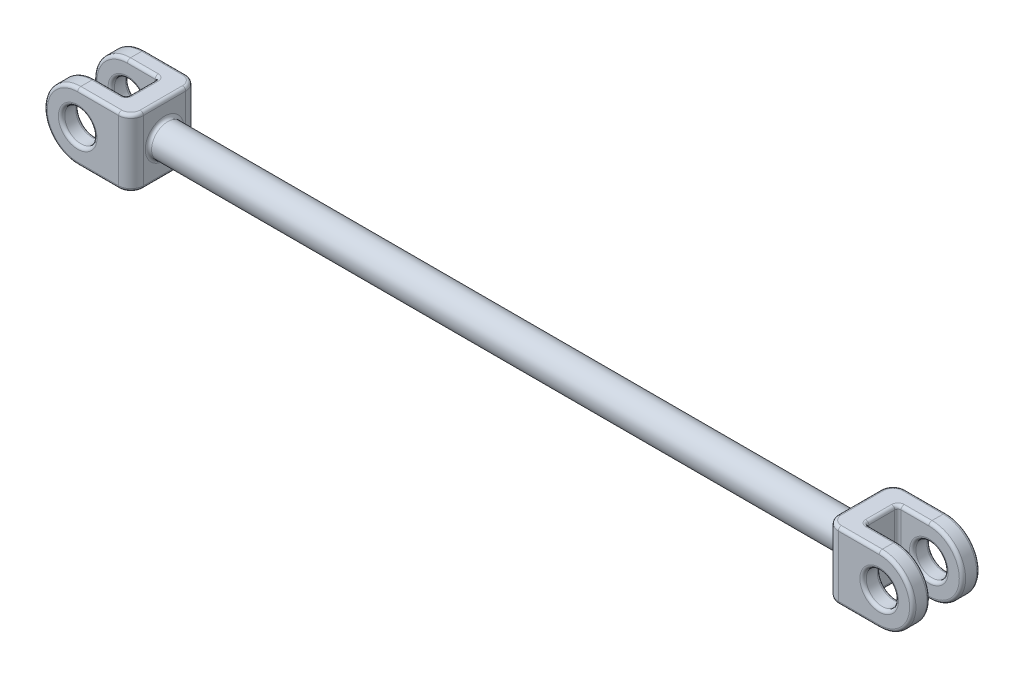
SolidWorks part; units mm, degrees
ref_plane "Front Plane" through (0, 0, 0) normal (0, 0, 1) x (1, 0, 0)
ref_plane "Top Plane" through (0, 0, 0) normal (0, 1, 0) x (1, 0, 0)
ref_plane "Right Plane" through (0, 0, 0) normal (1, 0, 0) x (0, 0, -1)
sketch "Sketch1" plane through (0, 0, 0) normal (0, 0, 1) x (1, 0, 0)
  line L1 (0, 8.5852) -> (0, -8.5852) construction
  line L9 (0, -8.5852) -> (13.6398, -8.5852)
  line L10 (13.6398, -8.5852) -> (13.6398, 8.5852)
  line L11 (13.6398, 8.5852) -> (0, 8.5852)
  arc A0 (0, 8.5852) -> (0, -8.5852) centre (0, 0) ccw
  circle A1 centre (0, 0) radius 4.1275
  dimension "D3" = 8.255
  dimension "D1" = 17.1704
  dimension "D2" = 22.225
extrude "Extrude1" add sketch "Sketch1" along normal mid plane 17.1704
sketch "Sketch4" plane through (0, 8.5852, 0) normal (0, 1, 0) x (-1, 0, 0)
  line L0 (0, 0) -> (14.7841, 0) construction
  line L1 (8.5852, -4.1275) -> (8.5852, 4.1275)
  line L3 (8.5852, -4.1275) -> (-7.9248, -4.1275)
  line L4 (8.5852, 4.1275) -> (-7.9248, 4.1275)
  line L5 (-7.9248, -4.1275) -> (-7.9248, 4.1275)
  line L6 (8.5852, -8.5852) -> (8.5852, 8.5852) construction
  point P8 (8.5852, 0)
  point P11 (-7.9248, 0)
  dimension "D1" = 8.255
  dimension "D2" = 16.51
extrude "Cut-Extrude2" cut sketch "Sketch4" against normal through all
sketch "Sketch8" plane through (13.6398, 0, 0) normal (1, 0, 0) x (0, 0, -1)
  circle A0 centre (0, 0) radius 4.1275
  dimension "D1" = 8.255
extrude "Extrude3" add sketch "Sketch8" along normal blind 88.9
mirror "Mirror1" about plane through (102.5398, 0, 0) normal (1, 0, 0)
fillet "Fillet5" radius 3.175 4 edges at (191.4398, 0, -8.5852) (191.4398, 0, 8.5852) (13.6398, 0, -8.5852) (13.6398, 0, 8.5852)
fillet "Fillet6" radius 0.8128 54 edges at (201.1172, 8.5852, -4.1275) (201.1172, 8.5852, 4.1275) (197.1548, 8.5852, 0) (201.1172, -8.5852, -4.1275) (201.1172, -8.5852, 4.1275) (197.1548, -8.5852, 0) (197.1548, 0, 4.1275) (197.1548, 0, -4.1275) (200.9521, 0, 4.1275) (213.6648, 0, 4.1275) (209.2071, 0, -4.1275) (213.6648, 0, -4.1275) (200.9521, 0, -8.5852) (200.9521, 0, 8.5852) (213.6648, 0, -8.5852) (199.8472, -8.5852, -8.5852) (199.8472, 8.5852, -8.5852) (213.6648, 0, 8.5852) (199.8472, -8.5852, 8.5852) (199.8472, 8.5852, 8.5852) (191.4398, 8.5852, 0) (191.4398, -8.5852, 0) (191.4398, 0, 4.1275) (3.9624, 8.5852, -4.1275) (3.9624, 8.5852, 4.1275) (7.9248, 8.5852, 0) (3.9624, -8.5852, -4.1275) (3.9624, -8.5852, 4.1275) (7.9248, -8.5852, 0) (7.9248, 0, 4.1275) (7.9248, 0, -4.1275) (4.1275, 0, 4.1275) (-8.5852, 0, 4.1275) (-4.1275, 0, -4.1275) (-8.5852, 0, -4.1275) (4.1275, 0, -8.5852) (4.1275, 0, 8.5852) (-8.5852, 0, -8.5852) (5.2324, -8.5852, -8.5852) (5.2324, 8.5852, -8.5852) (-8.5852, 0, 8.5852) (5.2324, -8.5852, 8.5852) (5.2324, 8.5852, 8.5852) (13.6398, 8.5852, 0) (13.6398, -8.5852, 0) (13.6398, 0, 4.1275) (192.3697, 8.5852, 7.6553) (192.3697, 8.5852, -7.6553) (192.3697, -8.5852, 7.6553) (192.3697, -8.5852, -7.6553) (12.7099, 8.5852, 7.6553) (12.7099, 8.5852, -7.6553) (12.7099, -8.5852, 7.6553) (12.7099, -8.5852, -7.6553)
